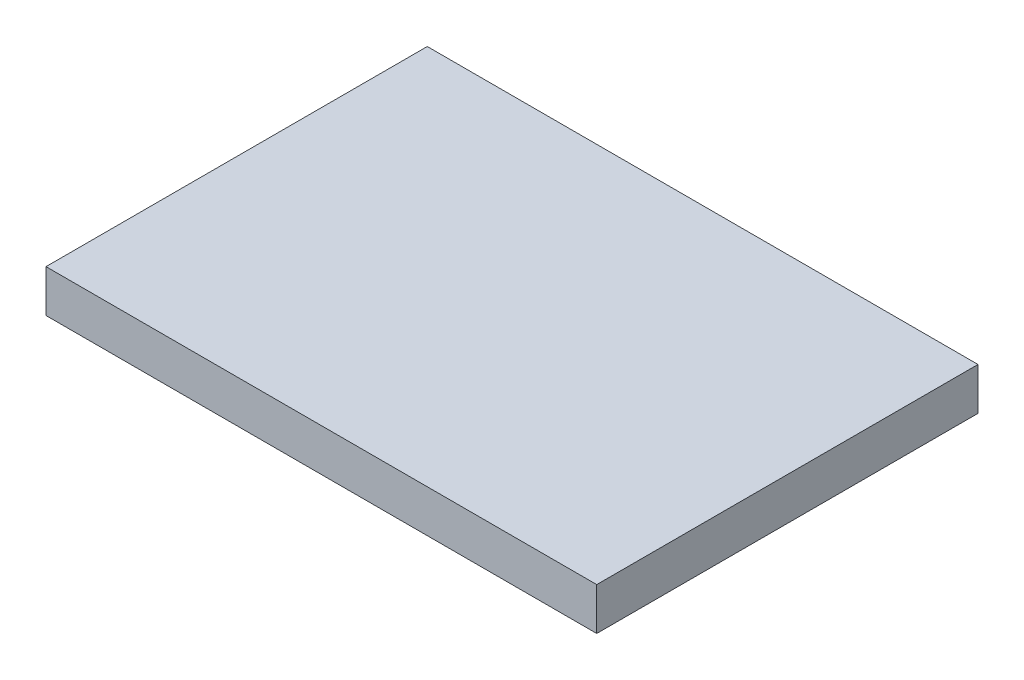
SolidWorks part; units mm, degrees
ref_plane "Plan de face" through (0, 0, 0) normal (0, 0, 1) x (1, 0, 0)
ref_plane "Plan de dessus" through (0, 0, 0) normal (0, 1, 0) x (1, 0, 0)
ref_plane "Plan de droite" through (0, 0, 0) normal (1, 0, 0) x (0, 0, -1)
sketch "Esquisse1" plane through (0, 0, 0) normal (0, 0, 1) x (1, 0, 0)
  line L1 (208.4718, 44.9892) -> (-116.5282, 44.9892)
  line L2 (208.4718, 44.9892) -> (208.4718, 69.9892)
  line L3 (208.4718, 69.9892) -> (-116.5282, 69.9892)
  line L4 (-116.5282, 44.9892) -> (-116.5282, 69.9892)
  dimension "D1" = 25
  dimension "D2" = 325
extrude "Boss.-Extru.1" add sketch "Esquisse1" along normal blind 225
